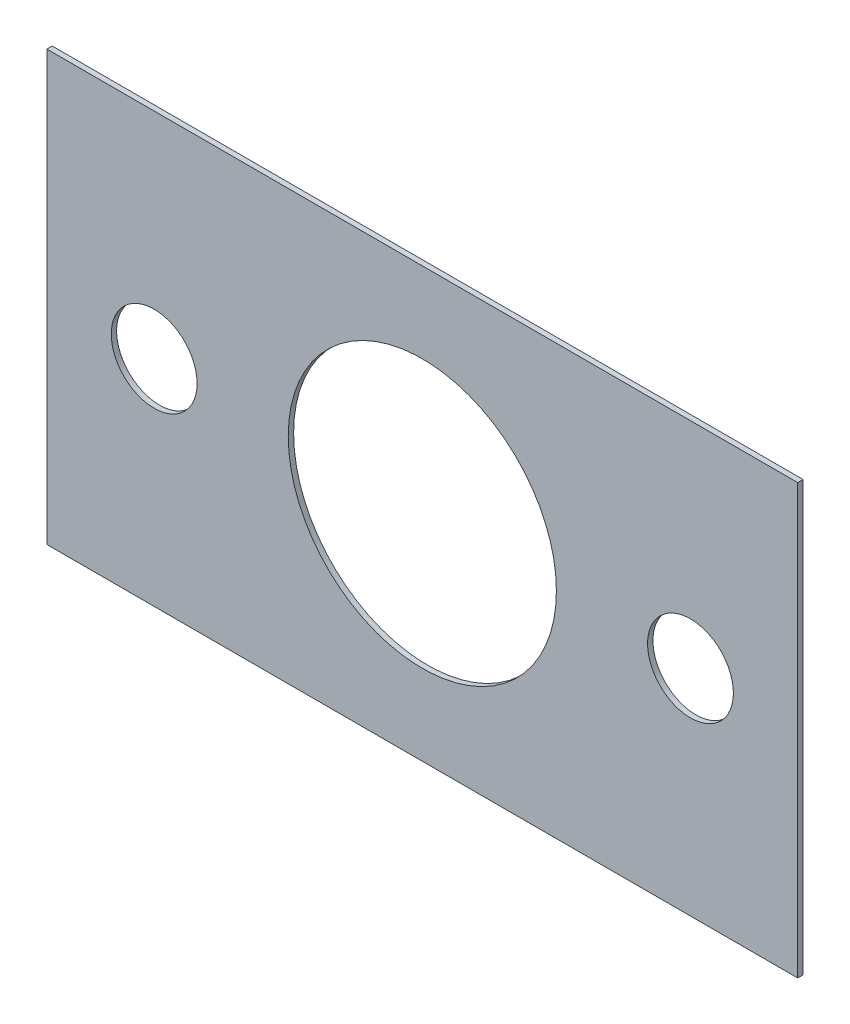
SolidWorks part; units mm, degrees
ref_plane "Alzado" through (0, 0, 0) normal (0, 0, 1) x (1, 0, 0)
ref_plane "Planta" through (0, 0, 0) normal (0, 1, 0) x (1, 0, 0)
ref_plane "Vista lateral" through (0, 0, 0) normal (1, 0, 0) x (0, 0, -1)
sketch "Croquis1" plane through (0, 0, 0) normal (0, 0, 1) x (1, 0, 0)
  line L1 (-35, 20) -> (35, 20)
  line L2 (-35, 20) -> (-35, -20)
  line L3 (-35, -20) -> (35, -20)
  line L4 (35, 20) -> (35, -20)
  circle A0 centre (0, 0) radius 12.5
  circle A1 centre (-25, 0) radius 4
  circle A2 centre (25, 0) radius 4
extrude "Extruir1" add sketch "Croquis1" along normal blind 0.5
